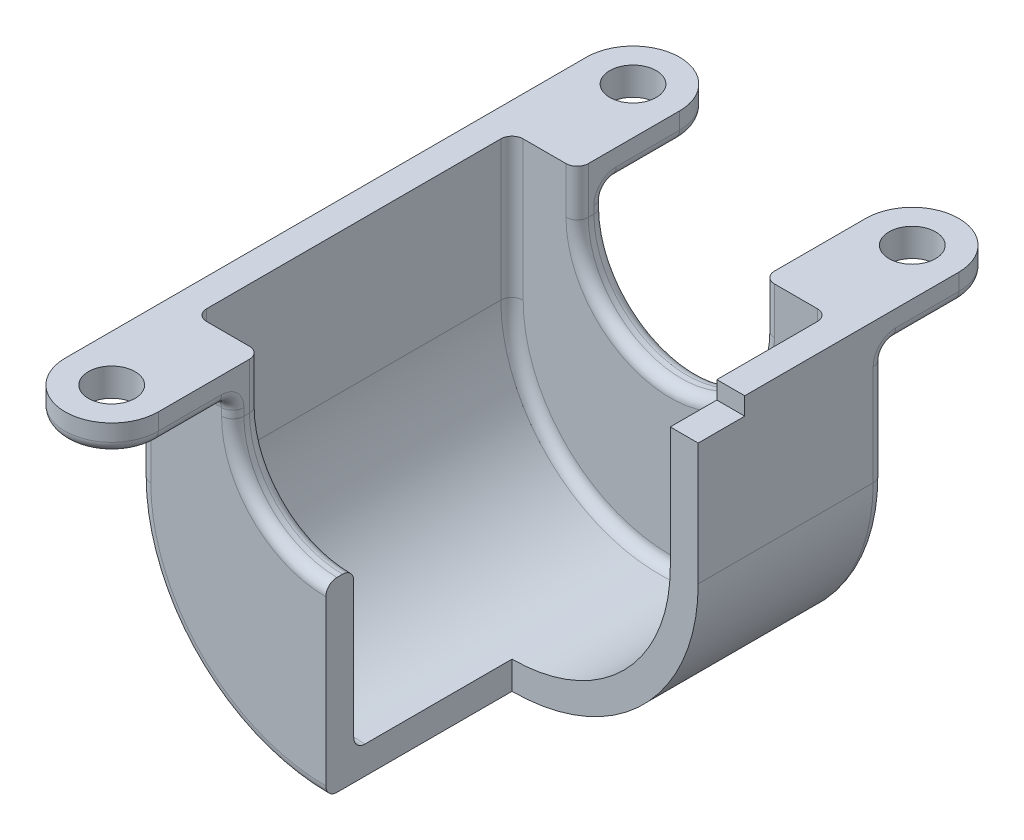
SolidWorks part; units mm, degrees
ref_plane "Front" through (0, 0, 0) normal (0, 0, 1) x (1, 0, 0)
ref_plane "Top" through (0, 0, 0) normal (0, 1, 0) x (1, 0, 0)
ref_plane "Right" through (0, 0, 0) normal (1, 0, 0) x (0, 0, -1)
sketch "Sketch1" plane through (0, 0, 0) normal (0, 0, 1) x (1, 0, 0)
  line L0 (-50.8, 0) -> (-50.8, 38.1)
  line L1 (-50.8, 38.1) -> (-25.4, 38.1)
  line L2 (-25.4, 38.1) -> (-25.4, 25.4)
  line L3 (50.8, 0) -> (50.8, 38.1)
  line L4 (50.8, 38.1) -> (25.4, 38.1)
  line L5 (25.4, 38.1) -> (25.4, 25.4)
  arc A0 (50.8, 0) -> (-50.8, 0) centre (0, 0) cw
  arc A1 (25.4, 25.4) -> (-25.4, 25.4) centre (0, 25.4) cw
  dimension "D1" = 50.8
  dimension "D2" = 25.4
  dimension "D3" = 38.1
extrude "Base-Extrude" add sketch "Sketch1" along normal mid plane 101.6
shell "Shell1" thickness 7.62
sketch "Sketch2" plane through (0, 38.1, 0) normal (0, 1, 0) x (-1, 0, 0)
  line L0 (50.8, 50.8) -> (50.8, 71.12)
  line L1 (50.8, 50.8) -> (25.4, 50.8)
  line L2 (25.4, 50.8) -> (25.4, 71.12)
  arc A0 (25.4, 71.12) -> (50.8, 71.12) centre (38.1, 71.12) cw
  dimension "D1" = 20.32
extrude "Boss-Extrude1" add sketch "Sketch2" against normal blind 7.62
sketch "Sketch3" plane through (0, 38.1, 0) normal (0, 1, 0) x (-1, 0, 0)
  circle A0 centre (38.1, 71.12) radius 6.35
  dimension "D1" = 12.7
extrude "Cut-Extrude1" cut sketch "Sketch3" against normal through all
mirror "Mirror1" about plane through (0, 0, 0) normal (1, 0, 0) of "Cut-Extrude1", "Boss-Extrude1"
mirror "Mirror2" about plane through (0, 0, 0) normal (0, 0, 1) of "Mirror1", "Boss-Extrude1", "Cut-Extrude1"
sketch "Sketch4" plane through (50.8, 0, 0) normal (1, 0, 0) x (0, 0, -1)
  line L0 (-71.12, 38.1) -> (71.12, 38.1) construction
  line L1 (-12.7, 38.1) -> (12.7, 38.1)
  line L2 (-12.7, 38.1) -> (-12.7, 33.274)
  line L3 (-12.7, 33.274) -> (12.7, 33.274)
  line L4 (12.7, 38.1) -> (12.7, 33.274)
  line L5 (0, 0) -> (0, 38.1) construction
  dimension "D1" = 4.826
  dimension "D2" = 25.4
extrude "Cut-Extrude2" cut sketch "Sketch4" against normal up to next
fillet "Fillet1" radius 3.048 8 edges at (-38.1, 30.48, -50.8) (38.1, 30.48, 50.8)
fillet "Fillet2" radius 3.048 44 edges at (-38.1, 30.48, -83.82) (-25.4, 30.48, -62.484) (-50.8, 30.48, -62.484) (-50.8, 13.716, -50.8) (50.8, 30.48, 62.484) (25.4, 26.416, 50.8) (-50.8, 29.5873, -51.6927) (-25.4, 29.5873, -51.6927) (50.8, 29.5873, -51.6927) (25.4, 29.5873, -51.6927) (50.8, 29.5873, 51.6927) (25.4, 29.5873, 51.6927) (-50.8, 29.5873, 51.6927) (-25.4, 29.5873, 51.6927) (0, 0, 50.8) (0, -43.18, -43.18) (43.18, 19.05, -43.18) (25.4, 31.75, -43.18) (0, 0, -43.18) (-25.4, 31.75, -43.18) (-43.18, 19.05, -43.18) (0, -43.18, 43.18) (43.18, 19.05, 43.18) (25.4, 31.75, 43.18) (0, 0, 43.18) (-25.4, 31.75, 43.18) (-43.18, 19.05, 43.18) (0, -50.8, 50.8) (-38.1, 30.48, 83.82) (38.1, 30.48, 83.82) (25.4, 30.48, 62.484) (50.8, 13.716, 50.8) (-25.4, 26.416, -50.8) (0, 0, -50.8) (38.1, 30.48, -83.82) (0, -50.8, -50.8)
sketch "Sketch5" plane through (0, 38.1, 0) normal (0, 1, 0) x (-1, 0, 0)
  line L1 (0, 0) -> (-50.8, 0)
  line L2 (0, 0) -> (0, 83.82)
  line L3 (0, 83.82) -> (-50.8, 83.82)
  line L4 (-50.8, 0) -> (-50.8, 83.82)
  line L6 (-50.8, 71.12) -> (-50.8, 12.7) construction
  arc A0 (-25.4, 71.12) -> (-50.8, 71.12) centre (-38.1, 71.12) ccw construction
extrude "Cut-Extrude3" cut sketch "Sketch5" against normal blind 112.395
